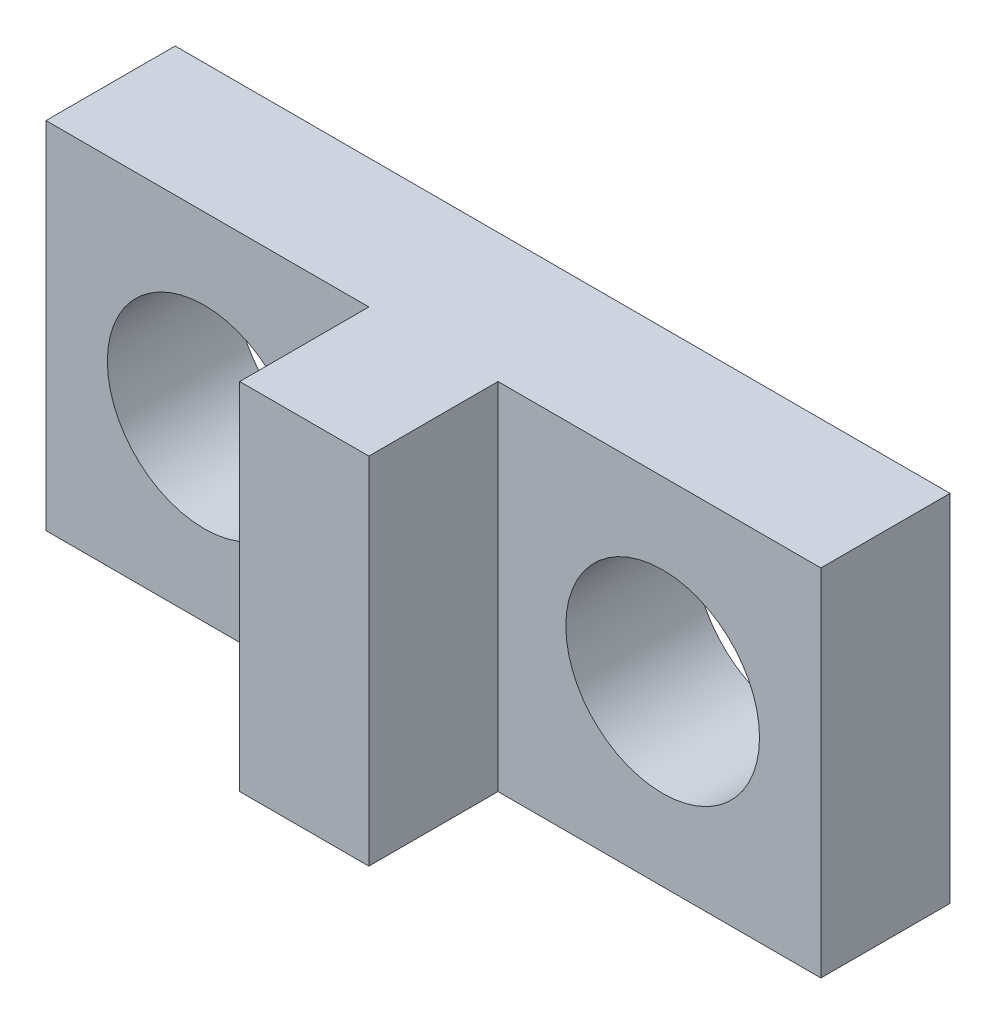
SolidWorks part; units mm, degrees
ref_plane "Planta" through (0, 0, 0) normal (0, 0, 1) x (1, 0, 0)
ref_plane "Perfil" through (0, 0, 0) normal (0, 1, 0) x (1, 0, 0)
ref_plane "Alzado" through (0, 0, 0) normal (1, 0, 0) x (0, 0, -1)
sketch "Croquis1" plane through (0, 0, 0) normal (0, 0, 1) x (1, 0, 0)
  line L0 (3.55, 0) -> (-3.55, 0) construction
  line L1 (6, -2.75) -> (-6, -2.75)
  line L2 (6, -2.75) -> (6, 2.75)
  line L3 (6, 2.75) -> (-6, 2.75)
  line L4 (-6, -2.75) -> (-6, 2.75)
  line L5 (6, -2.75) -> (-6, 2.75) construction
  line L6 (6, 2.75) -> (-6, -2.75) construction
  line L7 (0, 0) -> (0, -2.75) construction
  circle A0 centre (-3.55, 0) radius 1.5
  circle A1 centre (3.55, 0) radius 1.5
  point P0 (0, 0)
  dimension "D3" = 3
  dimension "D4" = 3
  dimension "D1" = 12
  dimension "D2" = 5.5
  dimension "D5" = 7.1
  dimension "D7" = 2.75
  dimension "D8" = 2.75
extrude "Saliente-Extruir1" add sketch "Croquis1" along normal blind 2
sketch "Croquis2" plane through (0, 0, 2) normal (0, 0, 1) x (1, 0, 0)
  line L1 (-6, -2.75) -> (6, -2.75) construction
  line L2 (-1, 2.75) -> (1, 2.75)
  line L3 (-1, 2.75) -> (-1, -2.75)
  line L4 (-1, -2.75) -> (1, -2.75)
  line L5 (1, 2.75) -> (1, -2.75)
  line L6 (-1, 2.75) -> (1, -2.75) construction
  line L7 (-1, -2.75) -> (1, 2.75) construction
  point P3 (0, 0)
  dimension "D1" = 2
extrude "Saliente-Extruir2" add sketch "Croquis2" along normal blind 2
